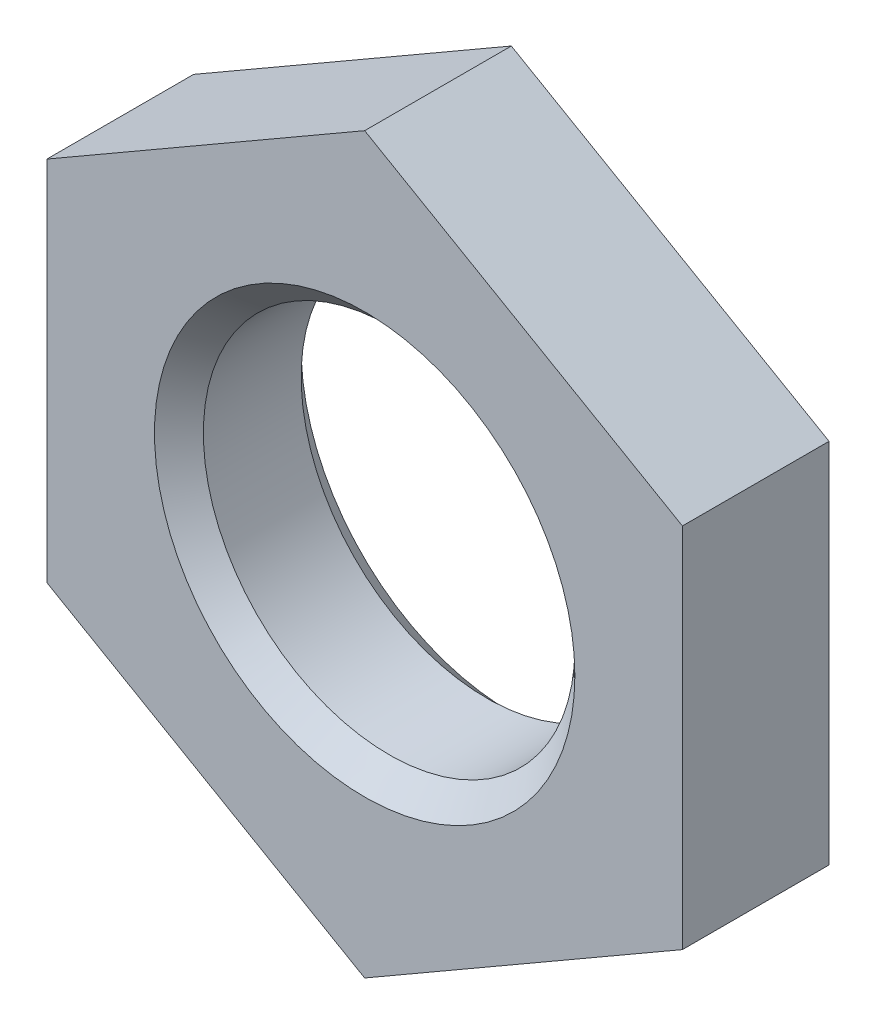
SolidWorks part; units mm, degrees
ref_plane "Plan de face" through (0, 0, 0) normal (0, 0, 1) x (1, 0, 0)
ref_plane "Plan de dessus" through (0, 0, 0) normal (0, 1, 0) x (1, 0, 0)
ref_plane "Plan de droite" through (0, 0, 0) normal (1, 0, 0) x (0, 0, -1)
sketch "Esquisse1" plane through (0, 0, 0) normal (0, 0, 1) x (1, 0, 0)
  line L1 (0, 7.5056) -> (-6.5, 3.7528)
  line L2 (-6.5, 3.7528) -> (-6.5, -3.7528)
  line L3 (-6.5, -3.7528) -> (0, -7.5056)
  line L4 (0, -7.5056) -> (6.5, -3.7528)
  line L5 (6.5, -3.7528) -> (6.5, 3.7528)
  line L6 (6.5, 3.7528) -> (0, 7.5056)
  circle A0 centre (0, 0) radius 6.5 construction
  dimension "D1" = 13
extrude "Extrusion1" add sketch "Esquisse1" along normal blind 3
hole_wizard "Dégagement M71" positions "Esquisse3D1" profile "Esquisse2" hole size "M7" standard "ISO"
sketch3d "Esquisse3D1"
  line L0 (-6.5, 3.7528, 3) -> (-6.5, -3.7528, 3) construction
  point P0 (0, -0.0006, 3)
  dimension "D1" = 7.505
  dimension "D2" = 6.5
sketch "Esquisse2" plane through (0, -0.0006, 3) normal (1, 0, 0) x (0, -1, 0)
  line L0 (0, 0) -> (0, 9.2833)
  line L1 (0, 9.2833) -> (3.8, 7)
  line L2 (3.8, 7) -> (3.8, 0)
  line L5 (3.8, 0) -> (0, 0)
  line L10 (0, 9.2833) -> (-3.8, 7) construction
  line L11 (0, -6.35) -> (0, 107.95) construction
  dimension "Diamètre du perçage" = 7.6
  dimension "Profondeur du perçage" = 7
  dimension "Angle de pointe" = 118
chamfer "Chanfrein1" distance 0.5 angle 45 2 edges at (3.8, -0.0006, 3) (3.8, -0.0006, 0)
